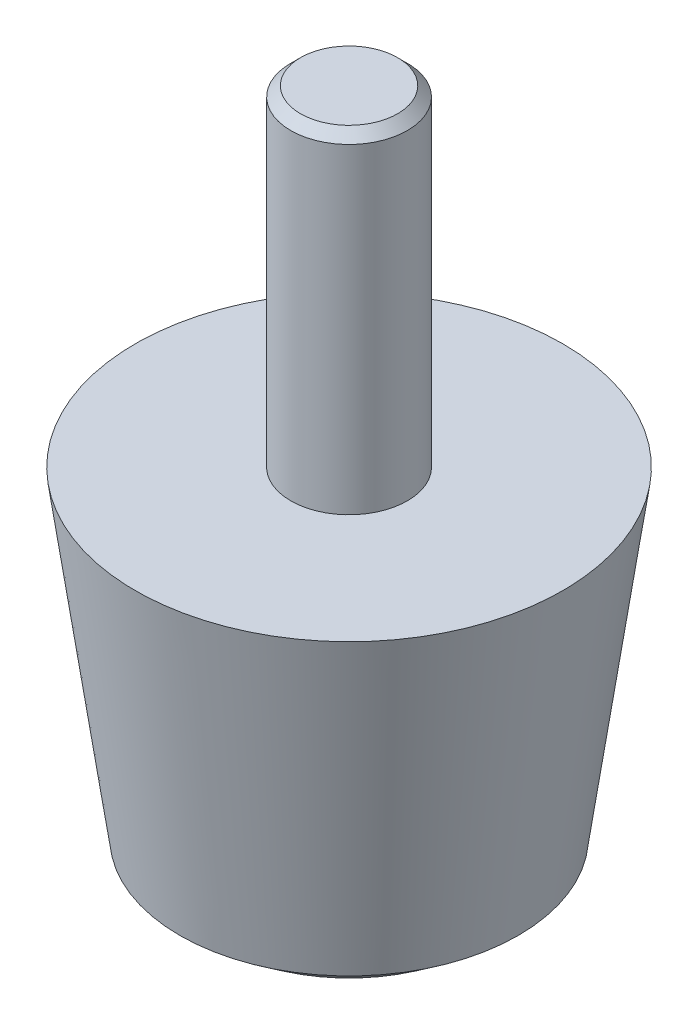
SolidWorks part; units mm, degrees
ref_plane "Face" through (0, 0, 0) normal (0, 0, 1) x (1, 0, 0)
ref_plane "Dessus" through (0, 0, 0) normal (0, 1, 0) x (1, 0, 0)
ref_plane "Droite" through (0, 0, 0) normal (1, 0, 0) x (0, 0, -1)
sketch "Esquisse1" plane through (0, 0, 0) normal (0, 0, 1) x (1, 0, 0)
  line L0 (0, -8.3038) -> (0, 29.6566) construction
  line L1 (0, 0) -> (0, 18)
  line L2 (0, 18) -> (11, 18)
  line L3 (11, 18) -> (8.5, 0)
  line L4 (8.5, 0) -> (0, 0)
  dimension "D1" = 18
  dimension "D2" = 22
  dimension "D3" = 17
revolve "Révolution1" add sketch "Esquisse1" angle 360 about L0
chamfer "Chanfrein1" distance 1.5 angle 45 1 edges at (0, 0, -8.5)
sketch "Esquisse2" plane through (0, 18, 0) normal (0, 1, 0) x (1, 0, 0)
  circle A0 centre (0, 0) radius 3
  dimension "D1" = 6
extrude "Extrusion1" add sketch "Esquisse2" along normal blind 17
chamfer "Chanfrein2" distance 0.5 angle 45 1 edges at (0, 35, 3)
